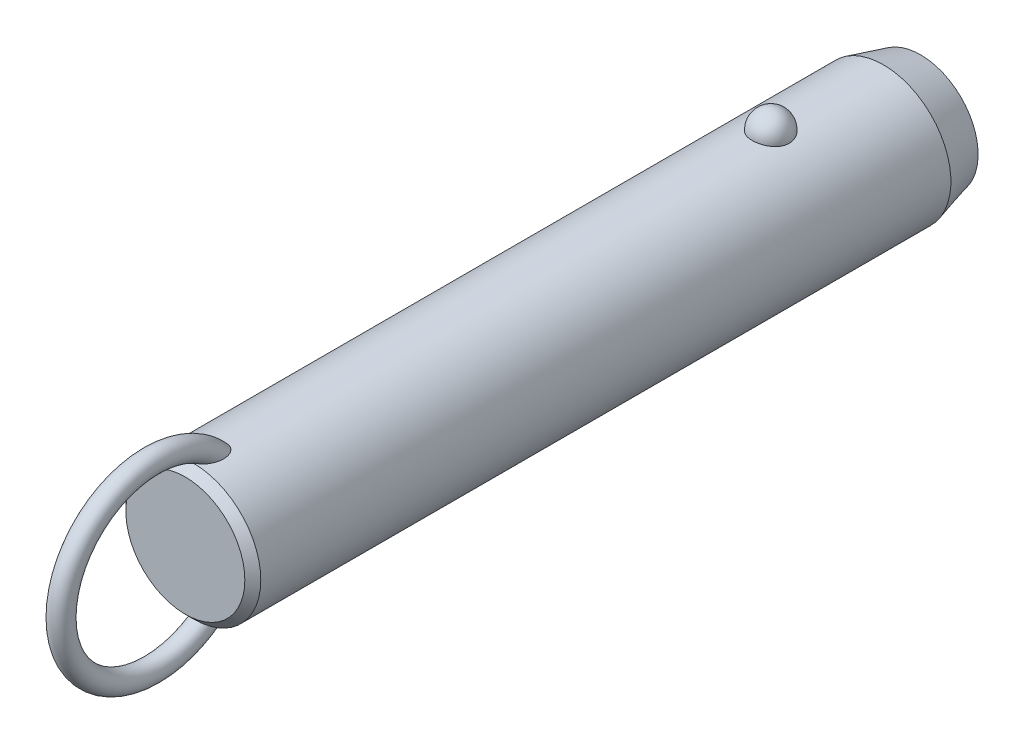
SolidWorks part; units mm, degrees
ref_plane "Front Plane" through (0, 0, 0) normal (0, 0, 1) x (1, 0, 0)
ref_plane "Top Plane" through (0, 0, 0) normal (0, 1, 0) x (1, 0, 0)
ref_plane "Right Plane" through (0, 0, 0) normal (1, 0, 0) x (0, 0, -1)
sketch "Sketch2" plane through (0, 0, 0) normal (0, 0, 1) x (1, 0, 0)
  circle A0 centre (0, 0) radius 12.7
  point P3 (0, 12.7)
  dimension "D1" = 25.4
extrude "Boss-Extrude1" add sketch "Sketch2" along normal blind 94
sketch "Sketch3" plane through (0, 0, 0) normal (0, 0, -1) x (-1, 0, 0)
  circle A0 centre (0, 0) radius 12.7
  dimension "D1" = 25.4
extrude "Boss-Extrude2" add sketch "Sketch3" along normal blind 31.7
chamfer "Chamfer1" distance 7 angle 15 1 edges at (-12.7, 0, -31.7)
sketch "Sketch12" plane through (0, 0, 0) normal (1, 0, 0) x (0, 0, -1)
  line L0 (-94, 12.7) -> (-94, -12.7) construction
  point P0 (-94, 0)
sketch "Sketch13" plane through (0, 0, 0) normal (1, 0, 0) x (0, 0, -1)
  circle A0 centre (-113.05, 0) radius 19.05
  point P2 (-94, 0)
  dimension "D1" = 38.1
sketch "Sketch14" plane through (0, 0, 0) normal (0, 1, 0) x (1, 0, 0)
  circle A0 centre (0, -96) radius 2
  point P2 (0, -94)
  dimension "D1" = 4
sweep "Sweep1" add profiles "Sketch14" path "Sketch13"
sketch "Sketch15" plane through (0, 0, 94) normal (0, 0, 1) x (1, 0, 0)
  circle A0 centre (0, 0) radius 12.7
  dimension "D1" = 25.4
extrude "Boss-Extrude3" add sketch "Sketch15" along normal blind 12.7
chamfer "Chamfer2" distance 1.5 angle 45 1 edges at (12.7, 0, 106.7)
sketch "Sketch18" plane through (0, 0, 0) normal (1, 0, 0) x (0, 0, -1)
  line L0 (24.7, 12.7) -> (-98.851, 12.7) construction
  line L1 (3.5, 16.2) -> (3.5, 9.2)
  line L2 (-98.851, -12.7) -> (24.7, -12.7) construction
  arc A0 (3.5, 16.2) -> (3.5, 9.2) centre (3.5, 12.7) ccw
  point P4 (0, 12.7)
  dimension "D1" = 28.9
revolve "Revolve1" add sketch "Sketch18" angle 360 about L1
